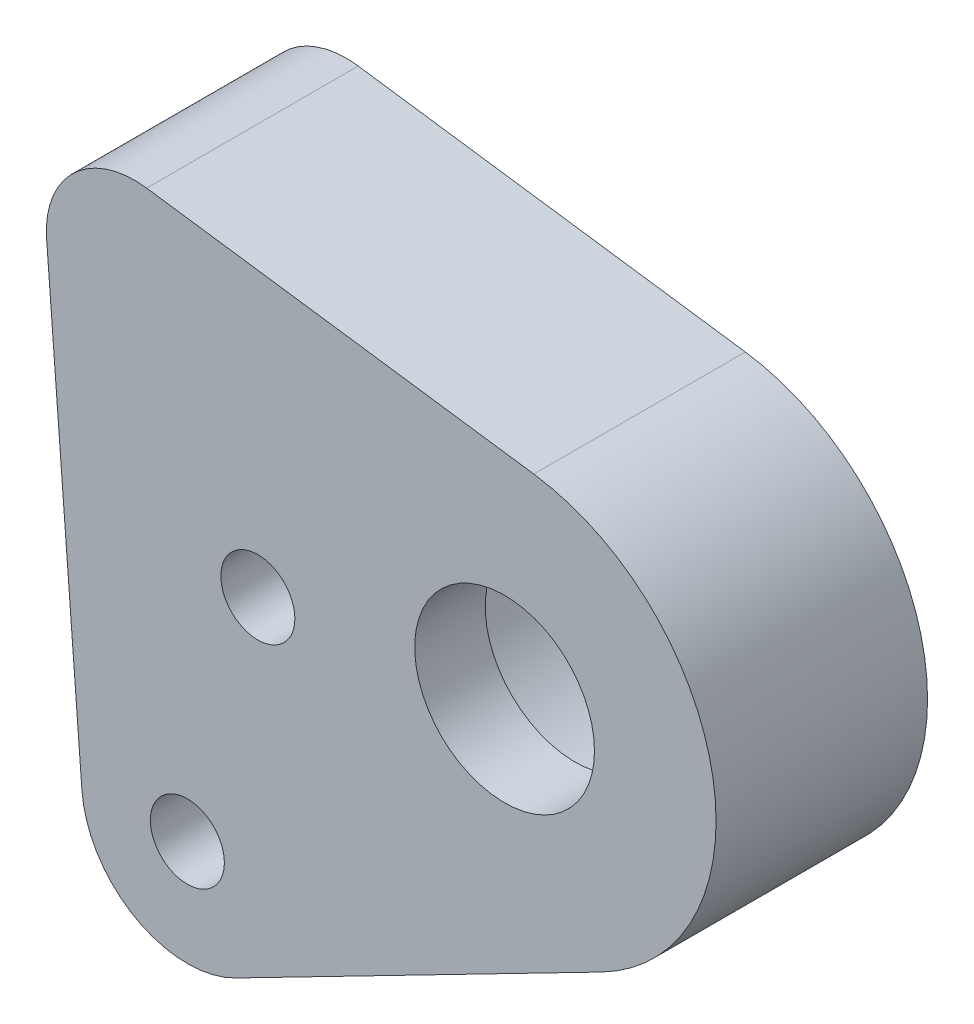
SolidWorks part; units mm, degrees
ref_plane "Alzado" through (0, 0, 0) normal (0, 0, 1) x (1, 0, 0)
ref_plane "Planta" through (0, 0, 0) normal (0, 1, 0) x (1, 0, 0)
ref_plane "Vista lateral" through (0, 0, 0) normal (1, 0, 0) x (0, 0, -1)
ref_plane "Plano1" through (0, 0, 54.4) normal (0, 0, 1) x (1, 0, 0)
sketch "Sk_Base_con_alojamiento_muelle" plane through (0, 0, 54.4) normal (0, 0, 1) x (1, 0, 0)
  line L0 (-31.9853, -16.3829) -> (-29.9824, -42.4595)
  line L1 (-21.2567, -47.3362) -> (-0.5135, -36.6723)
  line L2 (-4.3406, -14.1153) -> (-26.3086, -11.048)
  arc A0 (-29.9824, -42.4595) -> (-21.2567, -47.3362) centre (-24, -42) ccw
  arc A1 (-0.5135, -36.6723) -> (-4.3406, -14.1153) centre (-6, -26) ccw
  arc A2 (-26.3086, -11.048) -> (-31.9853, -16.3829) centre (-27, -16) ccw
  circle A3 centre (-6, -26) radius 9
  circle A4 centre (-20, -28) radius 2.1
  circle A5 centre (-24, -42) radius 2.1
extrude "Base_con_alojamiento_muelle" add sketch "Sk_Base_con_alojamiento_muelle" along normal blind 8
ref_plane "Plano2" through (0, 0, 62.4) normal (0, 0, 1) x (1, 0, 0)
sketch "Sk_Tapa" plane through (0, 0, 62.4) normal (0, 0, 1) x (1, 0, 0)
  line L0 (-31.9853, -16.3829) -> (-29.9824, -42.4595)
  line L1 (-21.2567, -47.3362) -> (-0.5135, -36.6723)
  line L2 (-4.3406, -14.1153) -> (-26.3086, -11.048)
  arc A0 (-29.9824, -42.4595) -> (-21.2567, -47.3362) centre (-24, -42) ccw
  arc A1 (-0.5135, -36.6723) -> (-4.3406, -14.1153) centre (-6, -26) ccw
  arc A2 (-26.3086, -11.048) -> (-31.9853, -16.3829) centre (-27, -16) ccw
  circle A3 centre (-6, -26) radius 5.1
  circle A4 centre (-20, -28) radius 2.1
  circle A5 centre (-24, -42) radius 2.1
extrude "Tapa" add sketch "Sk_Tapa" along normal blind 4
